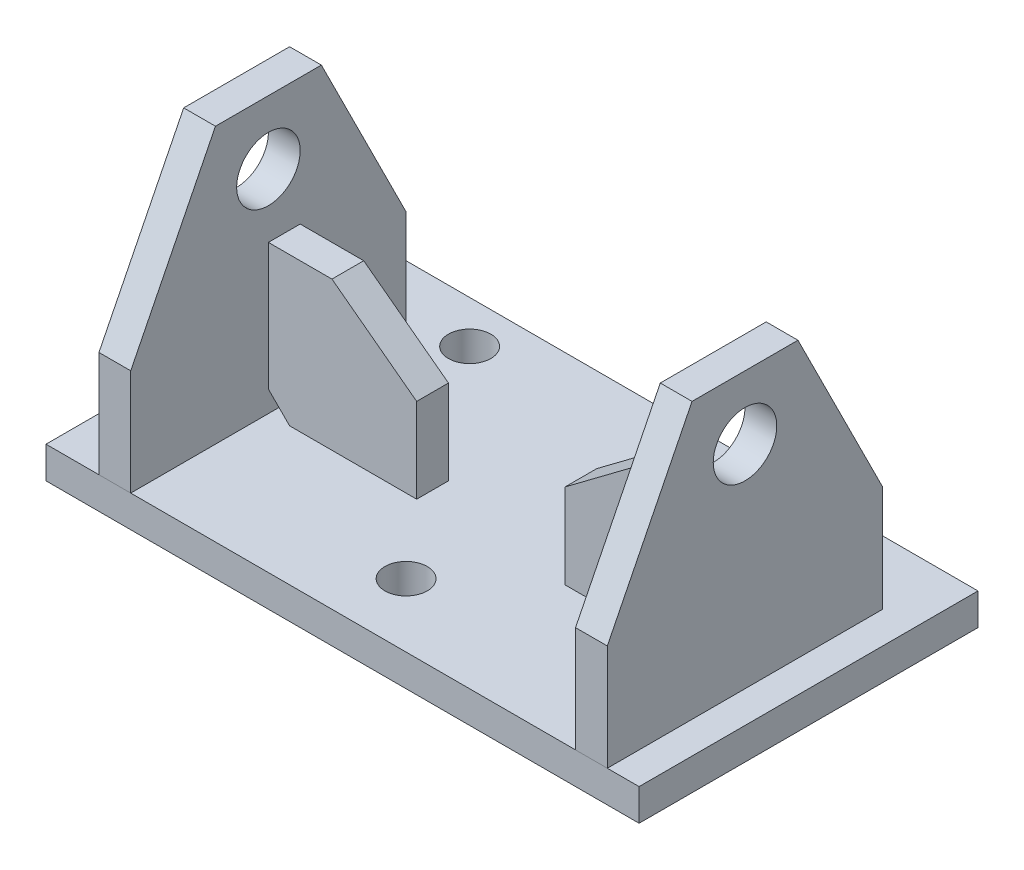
SolidWorks part; units mm, degrees
ref_plane "Front" through (0, 0, 0) normal (0, 0, 1) x (1, 0, 0)
ref_plane "Top" through (0, 0, 0) normal (0, 1, 0) x (1, 0, 0)
ref_plane "Right" through (0, 0, 0) normal (1, 0, 0) x (0, 0, -1)
sketch "Sketch1" plane through (0, 0, 0) normal (0, 1, 0) x (1, 0, 0)
  line L0 (-88.9, -50.8) -> (88.9, -50.8)
  line L1 (-88.9, -50.8) -> (-88.9, 50.8)
  line L2 (88.9, 50.8) -> (-88.9, 50.8)
  line L3 (88.9, 50.8) -> (88.9, -50.8)
  line L4 (-88.9, 50.8) -> (88.9, -50.8) construction
  dimension "D1" = 101.6
  dimension "D2" = 177.8
extrude "Plate" add sketch "Sketch1" along normal blind 9.525
sketch "Sketch2" plane through (0, 9.525, 0) normal (0, 1, 0) x (-1, 0, 0)
  line L1 (88.9, 50.8) -> (88.9, -50.8) construction
  line L2 (-88.9, -50.8) -> (88.9, -50.8) construction
  line L4 (0, -50.8) -> (0, 78.8221) construction
  circle A0 centre (50.8, -38.1) radius 6.35
  circle A1 centre (-50.8, -38.1) radius 6.35
  circle A2 centre (0, 31.75) radius 6.35
  dimension "D2" = 12.7
  dimension "D3" = 38.1
  dimension "D1" = 12.7
  dimension "D4" = 69.85
extrude "Holes" cut sketch "Sketch2" against normal through all
ref_plane "Plane1" through (-73.025, 0, 0) normal (-1, 0, 0) x (0, 0, 1)
sketch "Sketch3" plane through (-73.025, 0, 0) normal (-1, 0, 0) x (0, 0, 1)
  line L0 (50.8, 9.525) -> (-50.8, 9.525) construction
  line L1 (50.8, 9.525) -> (-31.75, 9.525)
  line L2 (50.8, 9.525) -> (50.8, 41.275)
  line L3 (-31.75, 9.525) -> (-31.75, 41.275)
  line L4 (-31.75, 41.275) -> (-6.35, 92.075)
  line L5 (-6.35, 92.075) -> (25.4, 92.075)
  line L6 (25.4, 92.075) -> (50.8, 41.275)
  line L7 (9.525, 9.525) -> (9.525, 92.075) construction
  circle A0 centre (9.525, 73.025) radius 9.525
  dimension "D5" = 19.05
  dimension "D6" = 63.5
  dimension "D1" = 82.55
  dimension "D2" = 50.8
  dimension "D3" = 25.4
  dimension "D4" = 82.55
extrude "Extrude1" add sketch "Sketch3" against normal blind 9.525 separate body
ref_plane "Plane2" through (0, 0, 9.525) normal (0, 0, 1) x (1, 0, 0)
sketch "Sketch4" plane through (0, 0, 9.525) normal (0, 0, 1) x (1, 0, 0)
  line L0 (-88.9, 9.525) -> (88.9, 9.525) construction
  line L1 (-63.5, 9.525) -> (-63.5, 41.275) construction
  line L2 (-63.5, 9.525) -> (-19.05, 9.525)
  line L3 (-63.5, 9.525) -> (-63.5, 53.975)
  line L4 (-63.5, 53.975) -> (-44.45, 53.975)
  line L5 (-44.45, 53.975) -> (-19.05, 34.925)
  line L6 (-19.05, 34.925) -> (-19.05, 9.525)
  dimension "D1" = 25.4
  dimension "D2" = 19.05
  dimension "D3" = 44.45
  dimension "D4" = 44.45
extrude "Extrude2" add sketch "Sketch4" against normal blind 9.525 separate body
chamfer "Chamfer1" distance 6.35 angle 45 1 edges at (-63.5, 9.525, 4.7625)
ref_plane "Plane3" through (3.175, 0, 0) normal (1, 0, 0) x (0, 0, -1)
mirror "Mirror1" about plane through (3.175, 0, 0) normal (1, 0, 0)
